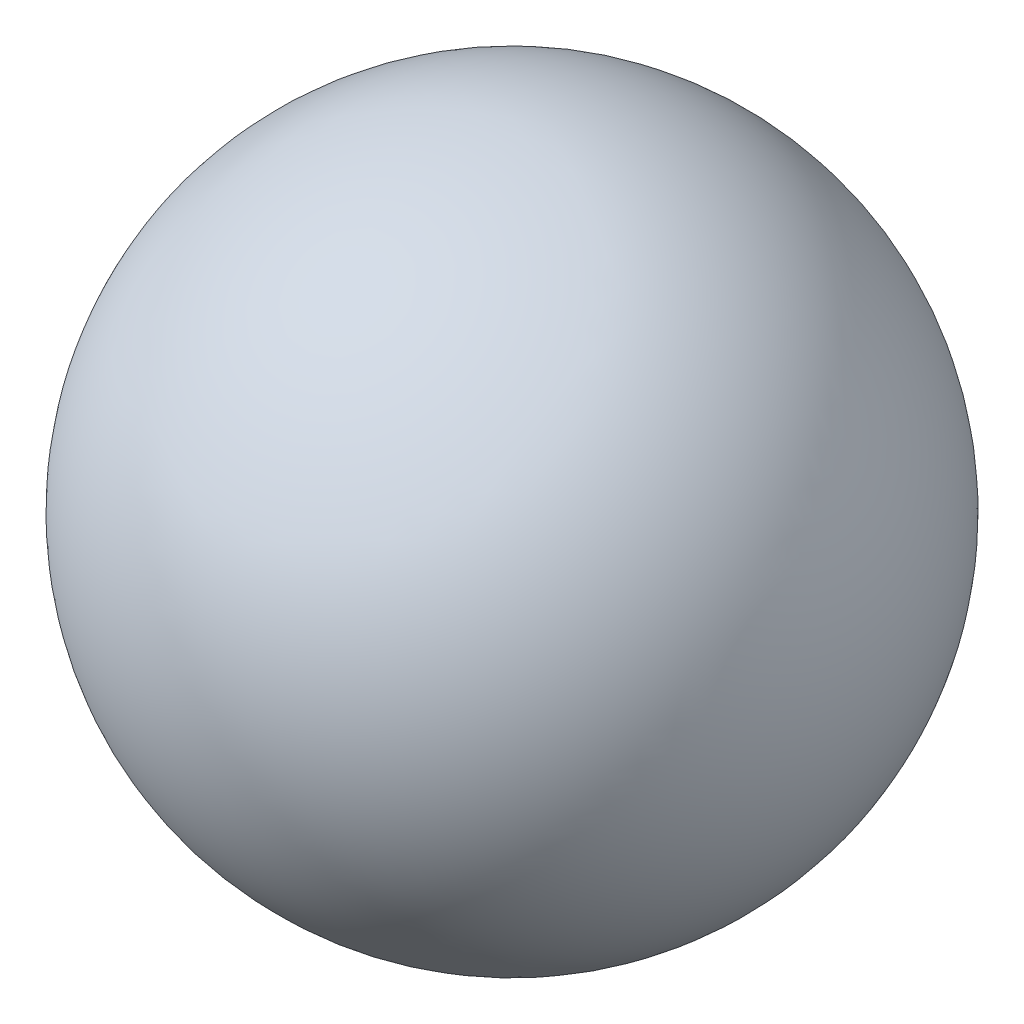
SolidWorks part; units mm, degrees
ref_plane "Plan1" through (0, 0, 0) normal (0, 0, 1) x (1, 0, 0)
ref_plane "Plan2" through (0, 0, 0) normal (0, 1, 0) x (1, 0, 0)
ref_plane "Plan3" through (0, 0, 0) normal (1, 0, 0) x (0, 0, -1)
sketch "Esquisse1" plane through (0, 0, 0) normal (0, 1, 0) x (1, 0, 0)
  line L1 (-0.3, 2.7) -> (6.7, 2.7) construction
  line L2 (-0.3, 5.4) -> (-0.3, 0) construction
  line L3 (6.7, 5.4) -> (6.7, 0) construction
  line L4 (1.4, 2.7) -> (5, 2.7)
  circle A1 centre (3.2, 2.7) radius 1.8 construction
  arc A2 (5, 2.7) -> (1.4, 2.7) centre (3.2, 2.7) ccw
revolve "Base-Révolution" add sketch "Esquisse1" angle 360 about L1
